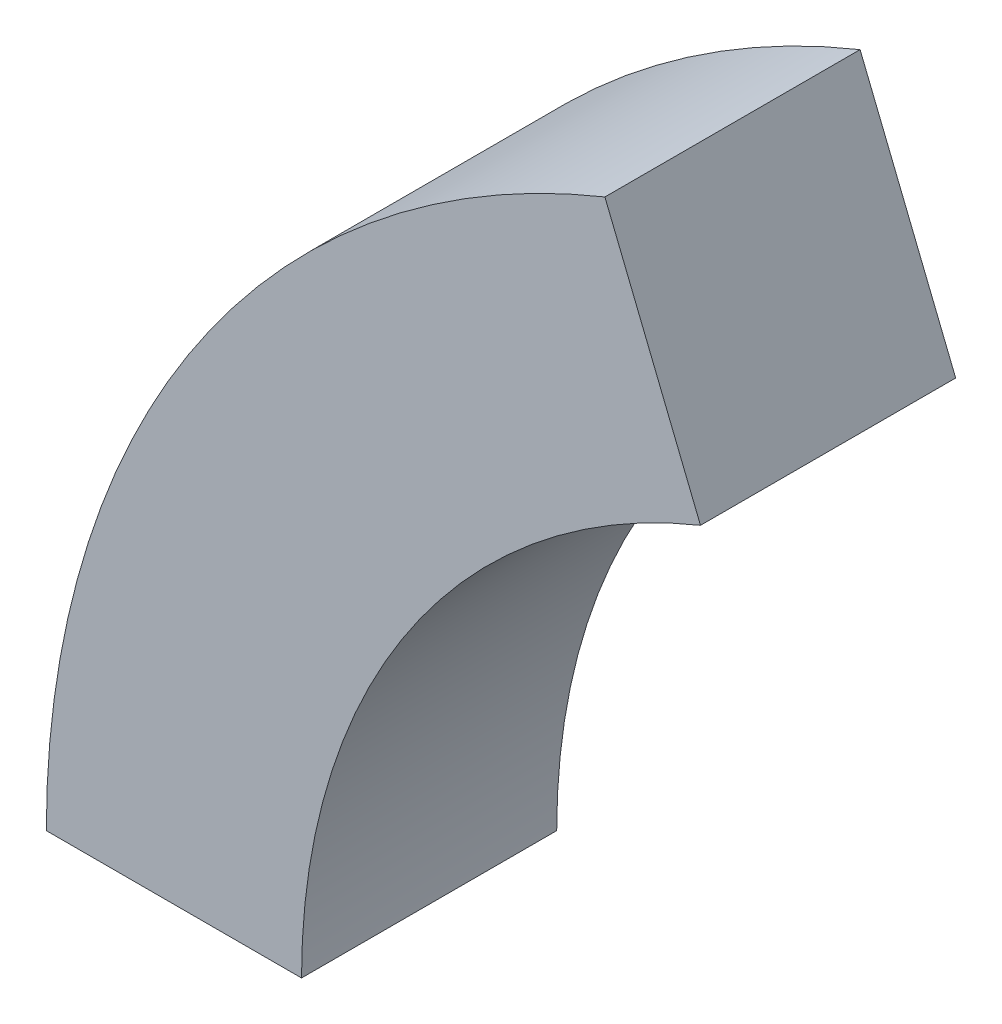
SolidWorks part; units mm, degrees
ref_plane "Plan de face" through (0, 0, 0) normal (0, 0, 1) x (1, 0, 0)
ref_plane "Plan de dessus" through (0, 0, 0) normal (0, 1, 0) x (1, 0, 0)
ref_plane "Plan de droite" through (0, 0, 0) normal (1, 0, 0) x (0, 0, -1)
sketch "Esquisse1" plane through (0, 0, 0) normal (0, 1, 0) x (1, 0, 0)
  line L1 (-14, 0) -> (0, 0)
  line L2 (-14, 0) -> (-14, 14)
  line L3 (-14, 14) -> (0, 14)
  line L4 (0, 0) -> (0, 14)
  dimension "D1" = 14
sketch "Esquisse2" plane through (0, 0, 0) normal (0, 0, 1) x (1, 0, 0)
  arc A0 (0, 0) -> (21.8888, 32.4514) centre (35, 0) cw
  dimension "D1" = 35
  dimension "D2" = 68
sweep "Balayage1" add profiles "Esquisse1" path "Esquisse2"
sketch "Esquisse3" plane through (0, 0, 0) normal (0, 1, 0) x (1, 0, 0)
  line L0 (35, -8.01) -> (35, 25.7774) construction
  dimension "D1" = 35
ref_plane "Plan1" through (10.9444, 16.2257, 0) normal (0.5592, 0.829, 0) x (-0.829, 0.5592, 0)
